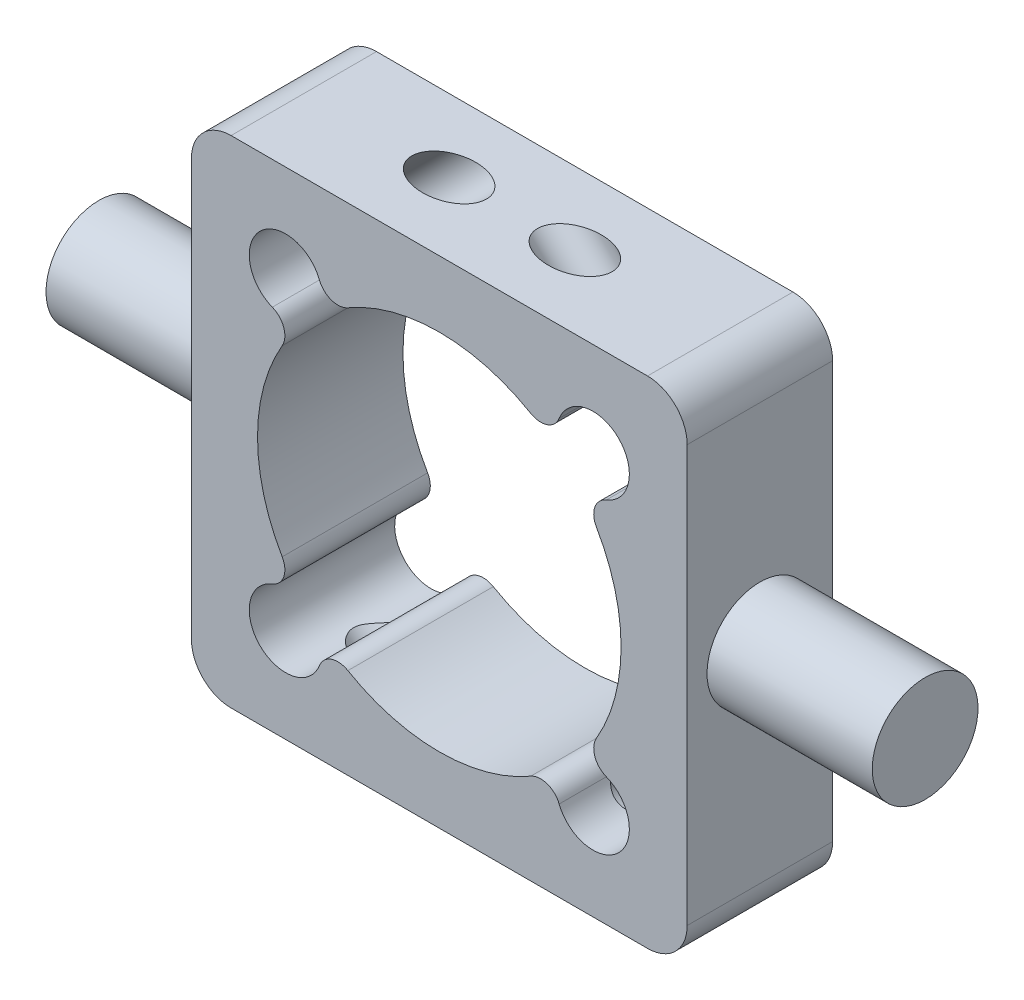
SolidWorks part; units mm, degrees
ref_plane "Plano frontal" through (0, 0, 0) normal (0, 0, 1) x (1, 0, 0)
ref_plane "Plano superior" through (0, 0, 0) normal (0, 1, 0) x (1, 0, 0)
ref_plane "Plano direito" through (0, 0, 0) normal (1, 0, 0) x (0, 0, -1)
sketch "Esboço1" plane through (0, 0, 0) normal (0, 0, 1) x (1, 0, 0)
  line L0 (0, 24.4094) -> (0, -31.769) construction
  line L1 (-37.5, 37.5) -> (37.5, 37.5)
  line L2 (-37.5, 37.5) -> (-37.5, -37.5)
  line L3 (-37.5, -37.5) -> (37.5, -37.5)
  line L4 (37.5, 37.5) -> (37.5, -37.5)
  line L5 (-35.6169, 0) -> (36.185, 0) construction
  arc A0 (-23.7687, 13.8312) -> (-23.7687, -13.8312) centre (0, 0) ccw
  arc A1 (-18.1318, 25.2634) -> (-25.2634, 18.1318) centre (-23.25, 23.25) ccw
  arc A2 (25.2634, 18.1318) -> (18.1318, 25.2634) centre (23.25, 23.25) ccw
  arc A3 (18.1318, -25.2634) -> (25.2634, -18.1318) centre (23.25, -23.25) ccw
  arc A4 (-25.2634, -18.1318) -> (-18.1318, -25.2634) centre (-23.25, -23.25) ccw
  arc A5 (13.8312, 23.7687) -> (-13.8312, 23.7687) centre (0, 0) ccw
  arc A6 (23.7687, -13.8312) -> (23.7687, 13.8312) centre (0, 0) ccw
  arc A7 (-13.8312, -23.7687) -> (13.8312, -23.7687) centre (0, 0) ccw
  arc A8 (-18.1318, 25.2634) -> (-13.8312, 23.7687) centre (-15.34, 26.3616) ccw
  arc A9 (-23.7687, 13.8312) -> (-25.2634, 18.1318) centre (-26.3616, 15.34) ccw
  arc A10 (-13.8312, -23.7687) -> (-18.1318, -25.2634) centre (-15.34, -26.3616) ccw
  arc A11 (-25.2634, -18.1318) -> (-23.7687, -13.8312) centre (-26.3616, -15.34) ccw
  arc A12 (13.8312, -23.7687) -> (18.1318, -25.2634) centre (15.34, -26.3616) cw
  arc A13 (23.7687, -13.8312) -> (25.2634, -18.1318) centre (26.3616, -15.34) ccw
  arc A14 (23.7687, 13.8312) -> (25.2634, 18.1318) centre (26.3616, 15.34) cw
  arc A15 (13.8312, 23.7687) -> (18.1318, 25.2634) centre (15.34, 26.3616) ccw
  point P28 (-18.6941, -20.1688)
  point P35 (20.1688, -18.6941)
  point P40 (18.6941, 20.1688)
  dimension "D2" = 55
  dimension "D4" = 11
  dimension "D6" = 3
  dimension "D1" = 75
  dimension "D3" = 46.5
  dimension "D5" = 46.5
extrude "Extrusão1" add sketch "Esboço1" along normal blind 22
sketch "Esboço2" plane through (-37.5, 0, 0) normal (-1, 0, 0) x (0, 0, 1)
  line L0 (11, 37.5) -> (11, -37.5) construction
  line L1 (22, 37.5) -> (0, 37.5) construction
  line L2 (22, -37.5) -> (0, -37.5) construction
  line L3 (0, 0) -> (22, 0) construction
  line L4 (0, 37.5) -> (0, -37.5) construction
  line L5 (22, 37.5) -> (22, -37.5) construction
  circle A0 centre (11, 0) radius 8
  dimension "D1" = 16
extrude "Extrusão2" add sketch "Esboço2" along normal blind 25
mirror "Espelhar1" about plane through (0, 0, 0) normal (1, 0, 0) of "Extrusão2"
fillet "Filete2" radius 6 4 edges at (-37.5, 37.5, 11) (37.5, 37.5, 11) (37.5, -37.5, 11) (-37.5, -37.5, 11)
ref_plane "Plano1" through (0, 0, 0) normal (1, 0, 0) x (0, 0, -1)
ref_plane "Plano2" through (3.5658, -3.5658, 0) normal (0.7071, -0.7071, 0) x (0.7071, 0.7071, 0)
ref_plane "Plano3" through (-17.6474, 17.6474, 0) normal (0.7071, -0.7071, 0) x (0.7071, 0.7071, 0)
sketch "Esboço6" plane through (-17.6474, 17.6474, 0) normal (0.7071, -0.7071, 0) x (0.7071, 0.7071, 0)
  line L0 (31.9952, 11) -> (-1.9393, 11) construction
  line L1 (48.7904, 0) -> (4.2426, 0) construction
  line L2 (48.7904, 22) -> (4.2426, 22) construction
  line L3 (4.2426, 0) -> (4.2426, 22) construction
  circle A0 centre (33.2426, 11) radius 4
  dimension "D1" = 8
  dimension "D2" = 29
extrude "Extrusão5" cut sketch "Esboço6" along normal blind 25
mirror "Espelhar2" about plane through (0, 0, 0) normal (1, 0, 0) of "Extrusão5"
mirror "Espelhar3" about plane through (0, 0, 0) normal (0, 1, 0) of "Espelhar2", "Extrusão5"
